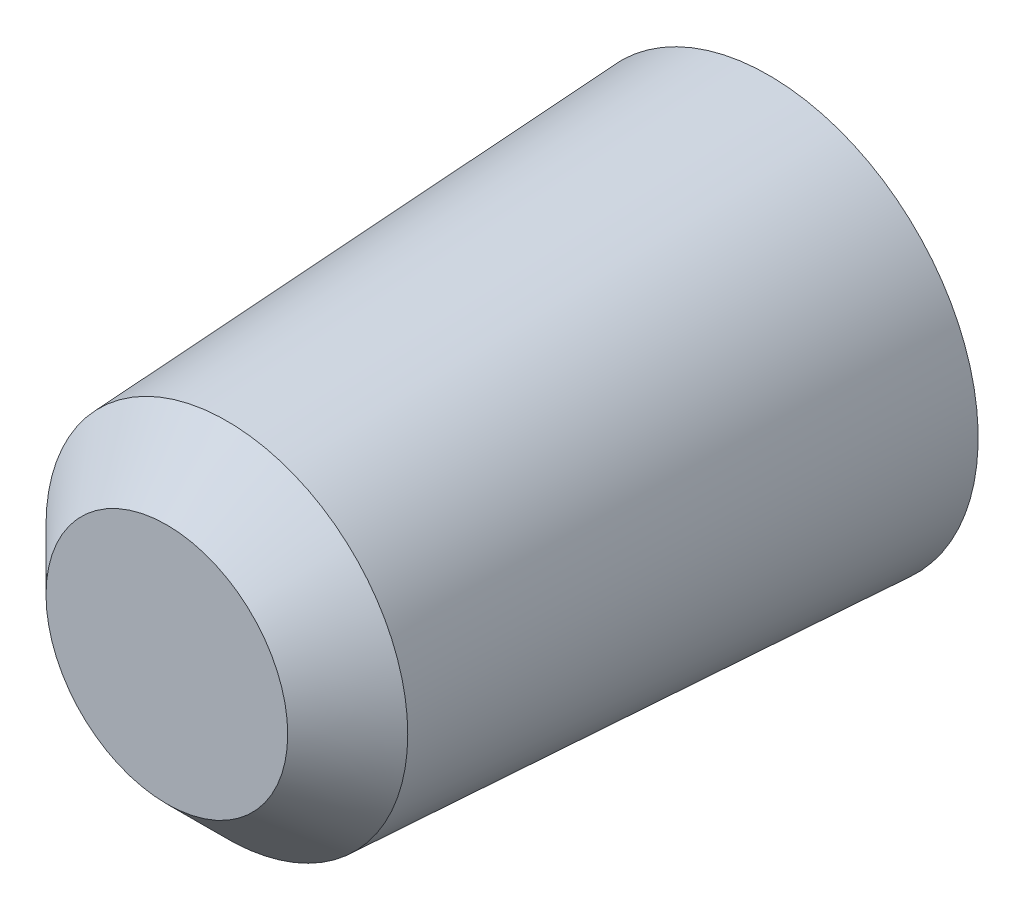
SolidWorks part; units mm, degrees
other "<Masselotte>-<Chanfrein1>"
ref_plane "Plan de face" through (0, 0, 0) normal (0, 0, 1) x (1, 0, 0)
ref_plane "Plan de dessus" through (0, 0, 0) normal (0, 1, 0) x (1, 0, 0)
ref_plane "Plan de droite" through (0, 0, 0) normal (1, 0, 0) x (0, 0, -1)
mirrored part "Masselotte_Symétrique"
